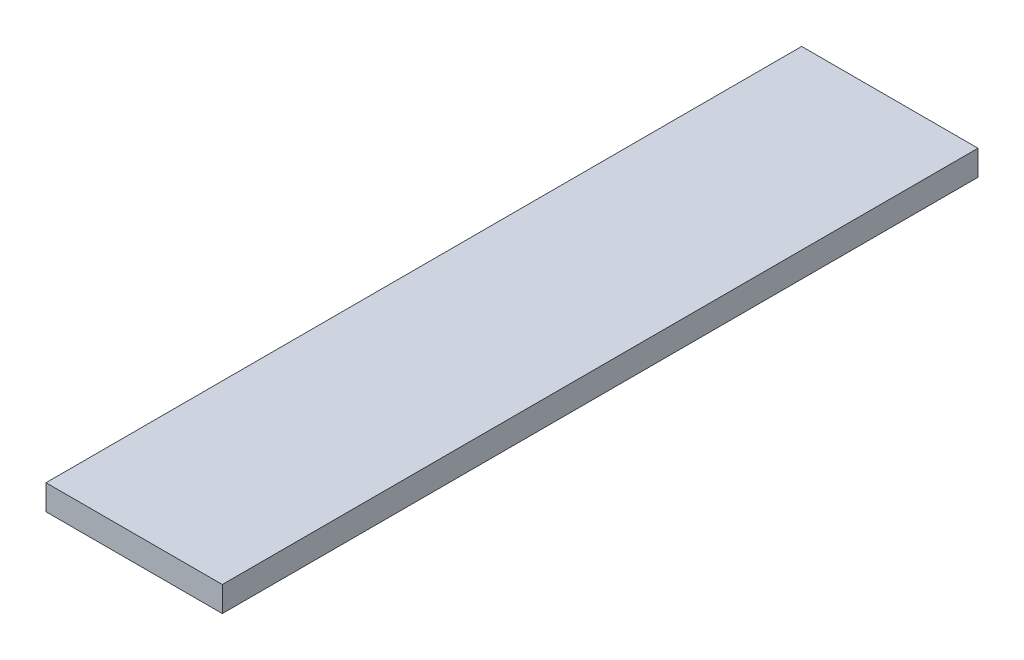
SolidWorks part; units mm, degrees
ref_plane "Front" through (0, 0, 0) normal (0, 0, 1) x (1, 0, 0)
ref_plane "Top" through (0, 0, 0) normal (0, 1, 0) x (1, 0, 0)
ref_plane "Right" through (0, 0, 0) normal (1, 0, 0) x (0, 0, -1)
sketch "Sketch1" plane through (0, 0, 0) normal (0, 1, 0) x (1, 0, 0)
  line L1 (-3.5, -15) -> (3.5, -15)
  line L2 (-3.5, -15) -> (-3.5, 15)
  line L3 (-3.5, 15) -> (3.5, 15)
  line L4 (3.5, -15) -> (3.5, 15)
  line L5 (-3.5, -15) -> (3.5, 15) construction
  line L6 (-3.5, 15) -> (3.5, -15) construction
  point P0 (0, 0)
  dimension "D1" = 7
  dimension "D2" = 30
extrude "Boss-Extrude1" add sketch "Sketch1" along normal mid plane 1
